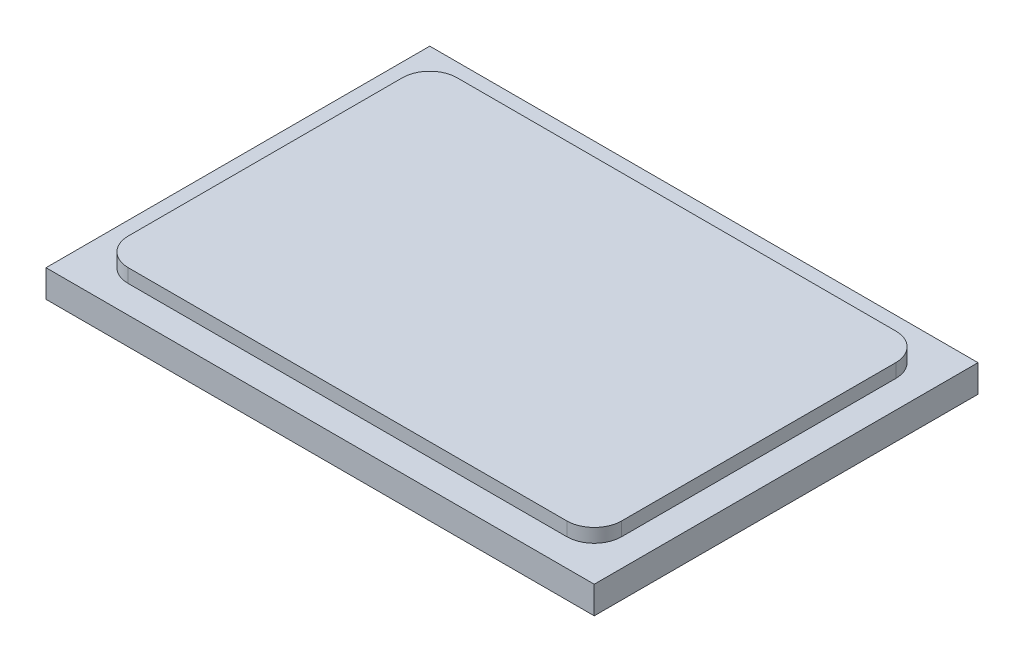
SolidWorks part; units mm, degrees
ref_plane "Front Plane" through (0, 0, 0) normal (0, 0, 1) x (1, 0, 0)
ref_plane "Top Plane" through (0, 0, 0) normal (0, 1, 0) x (1, 0, 0)
ref_plane "Right Plane" through (0, 0, 0) normal (1, 0, 0) x (0, 0, -1)
sketch "Sketch1" plane through (0, 0, 0) normal (0, 1, 0) x (1, 0, 0)
  line L1 (-41.3183, 25.2552) -> (85.6817, 25.2552)
  line L2 (-41.3183, 25.2552) -> (-41.3183, -63.6448)
  line L3 (-41.3183, -63.6448) -> (85.6817, -63.6448)
  line L4 (85.6817, 25.2552) -> (85.6817, -63.6448)
  dimension "D1" = 88.9
  dimension "D2" = 127
extrude "Boss-Extrude1" add sketch "Sketch1" along normal blind 6.35
sketch "Sketch2" plane through (0, 6.35, 0) normal (0, 1, 0) x (1, 0, 0)
  line L0 (-41.3183, 25.2552) -> (-41.3183, -63.6448) construction
  line L1 (-34.9683, 18.9052) -> (79.3317, 18.9052)
  line L2 (-34.9683, 18.9052) -> (-34.9683, -57.2948)
  line L3 (-34.9683, -57.2948) -> (79.3317, -57.2948)
  line L4 (79.3317, 18.9052) -> (79.3317, -57.2948)
  line L5 (85.6817, 25.2552) -> (-41.3183, 25.2552) construction
  dimension "D1" = 114.3
  dimension "D2" = 76.2
  dimension "D3" = 6.35
  dimension "D4" = 6.35
extrude "Boss-Extrude2" add sketch "Sketch2" along normal blind 3.175
sketch "Sketch3" plane through (0, 9.525, 0) normal (0, 1, 0) x (1, 0, 0)
  line L0 (79.3317, 18.9052) -> (-34.9683, 18.9052) construction
  line L1 (-34.9683, 18.9052) -> (-34.9683, -57.2948) construction
  line L2 (-34.9683, -57.2948) -> (79.3317, -57.2948) construction
  line L3 (79.3317, -57.2948) -> (79.3317, 18.9052) construction
  line L4 (-34.9683, -57.2948) -> (79.3317, -57.2948) construction
  line L5 (-34.9683, 12.5552) -> (-34.9683, 18.9052)
  line L6 (-34.9683, 18.9052) -> (-28.6183, 18.9052)
  line L7 (-28.6183, 18.9052) -> (-34.9683, 12.5552)
  line L8 (-34.9683, -57.2948) -> (-34.9683, -50.9448)
  line L9 (-34.9683, -50.9448) -> (-28.6183, -57.2948)
  line L10 (-28.6183, -57.2948) -> (-34.9683, -57.2948)
  line L11 (72.9817, -57.2948) -> (79.3317, -57.2948)
  line L12 (79.3317, -57.2948) -> (79.3317, -50.9448)
  line L13 (79.3317, -50.9448) -> (72.9817, -57.2948)
  line L14 (72.9817, 18.9052) -> (79.3317, 18.9052)
  line L15 (79.3317, 18.9052) -> (79.3317, 12.5552)
  line L16 (79.3317, 12.5552) -> (72.9817, 18.9052)
  circle A0 centre (-28.6183, 12.5552) radius 6.35
  circle A1 centre (72.9817, 12.5552) radius 6.35
  circle A2 centre (72.9817, -50.9448) radius 6.35
  circle A3 centre (-28.6183, -50.9448) radius 6.35
  dimension "D1" = 6.35
  dimension "D2" = 6.35
  dimension "D3" = 6.35
  dimension "D4" = 6.35
  dimension "D5" = 6.35
  dimension "D6" = 6.35
  dimension "D7" = 6.35
  dimension "D8" = 6.35
extrude "Cut-Extrude1" cut sketch "Sketch3" against normal blind 3.175 contours A1 M3 M4 | A2 M2 M3 | A3 M1 M2 | A0 M4 M1
